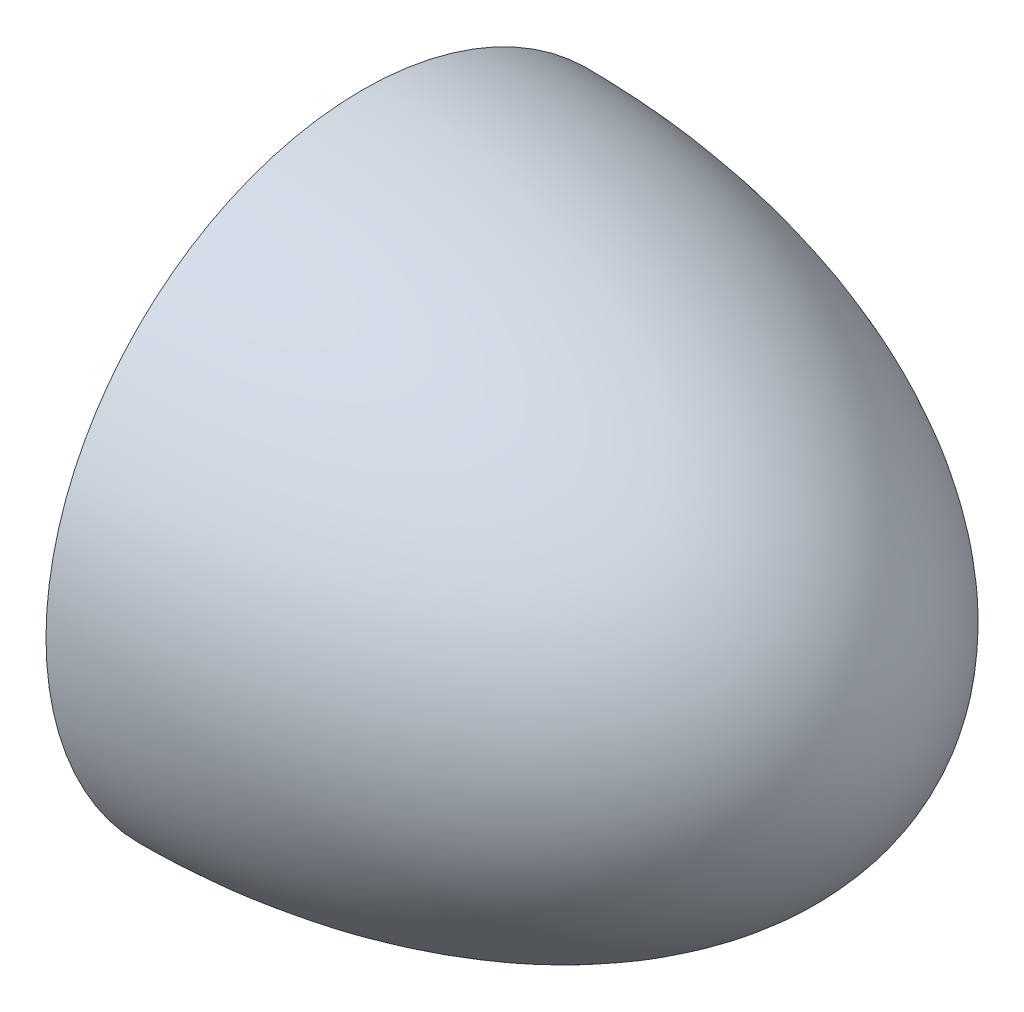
SolidWorks part; units mm, degrees
ref_plane "Front Plane" through (0, 0, 0) normal (0, 0, 1) x (1, 0, 0)
ref_plane "Top Plane" through (0, 0, 0) normal (0, 1, 0) x (1, 0, 0)
ref_plane "Right Plane" through (0, 0, 0) normal (1, 0, 0) x (0, 0, -1)
sketch "Sketch1" plane through (0, 0, 0) normal (0, 0, 1) x (1, 0, 0)
  line L0 (0, 0) -> (57.7411, 0) construction
  line L1 (0, 5.74) -> (0, 0)
  line L2 (0, 0) -> (9.58, 0)
  ellipse E0 centre (0, 0) end of major axis (9.58, 0) minor radius 5.74 (9.58, 0) -> (0, 5.74) ccw
revolve "Revolve1" add sketch "Sketch1" angle 360 about L0
